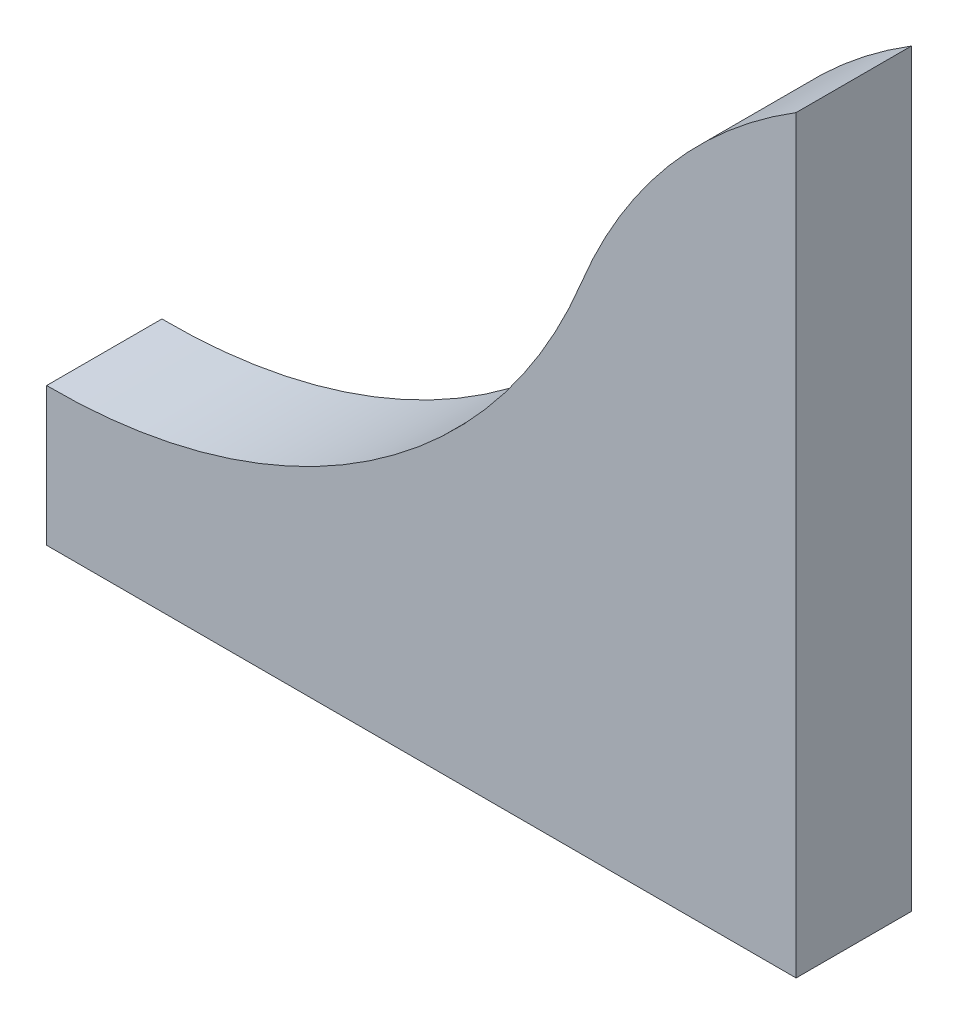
SolidWorks part; units mm, degrees
ref_plane "前视基准面" through (0, 0, 0) normal (0, 0, 1) x (1, 0, 0)
ref_plane "上视基准面" through (0, 0, 0) normal (0, 1, 0) x (1, 0, 0)
ref_plane "右视基准面" through (0, 0, 0) normal (1, 0, 0) x (0, 0, -1)
sketch "Sketch1" plane through (0, 0, 0) normal (0, 0, 1) x (1, 0, 0)
  line L0 (-65, 0) -> (0, 0)
  line L1 (0, 0) -> (0, 65)
  line L2 (-65, 0) -> (-65, 12.0003)
  arc A0 (-65, 12.0003) -> (-18.6022, 42.955) centre (-64.5131, 61.5206) ccw
  arc A1 (0, 65) -> (-18.6022, 42.955) centre (24.3408, 25.5896) ccw
  dimension "D1" = 65
  dimension "D2" = 65
extrude "Extrude1" add sketch "Sketch1" along normal blind 10
